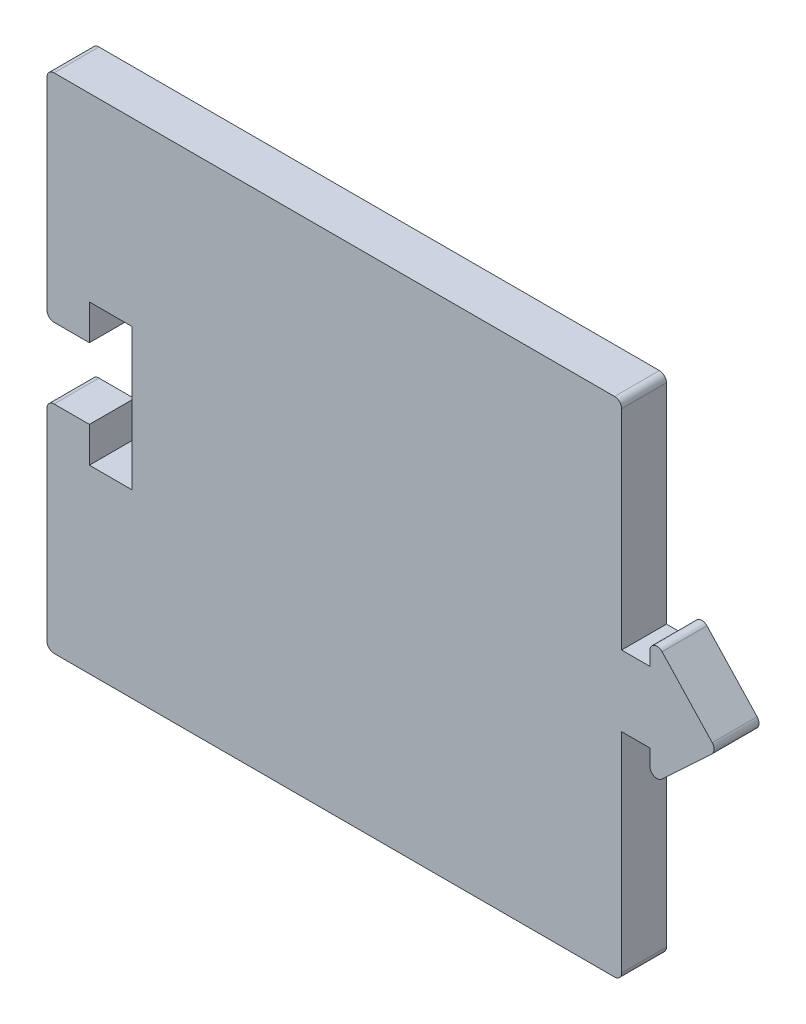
SolidWorks part; units mm, degrees
ref_plane "Front" through (0, 0, 0) normal (0, 0, 1) x (1, 0, 0)
ref_plane "Top" through (0, 0, 0) normal (0, 1, 0) x (1, 0, 0)
ref_plane "Right" through (0, 0, 0) normal (1, 0, 0) x (0, 0, -1)
sketch "Sketch1" plane through (0, 0, 0) normal (0, 0, 1) x (1, 0, 0)
  line L0 (0, 0) -> (0, 15.28) construction
  line L1 (40.64, 35.56) -> (40.64, 20.28)
  line L2 (40.64, 0) -> (0, 0) construction
  line L3 (0, 35.56) -> (40.64, 35.56) construction
  line L4 (0, 17.78) -> (40.64, 17.78) construction
  line L5 (20.32, 35.56) -> (20.32, 0) construction
  line L6 (0, 35.56) -> (40.64, 35.56)
  line L7 (0, 0) -> (40.64, 0)
  line L8 (40.64, 20.28) -> (42.64, 20.28)
  line L9 (42.64, 20.28) -> (42.64, 22.53)
  line L10 (42.64, 22.53) -> (47.39, 17.445)
  line L11 (47.39, 17.445) -> (42.64, 13.0079)
  line L12 (42.64, 13.0079) -> (42.64, 15.28)
  line L13 (42.64, 15.28) -> (40.64, 15.28)
  line L14 (0, 20.28) -> (3, 20.28)
  line L15 (3, 20.28) -> (3, 22.78)
  line L16 (0, 35.56) -> (0, 20.28)
  line L17 (0, 20.28) -> (0, 35.56) construction
  line L18 (0, 15.28) -> (0, 0)
  line L19 (3, 22.78) -> (6, 22.78)
  line L20 (6, 22.78) -> (6, 12.78)
  line L21 (40.64, 15.28) -> (40.64, 0)
  line L22 (6, 12.78) -> (3, 12.78)
  line L23 (0, 15.28) -> (3, 15.28)
  line L24 (3, 12.78) -> (3, 15.28)
  point P17 (6, 17.78)
  dimension "D10" = 2.5
  dimension "D1" = 35.56
  dimension "D2" = 2
  dimension "D3" = 40.64
  dimension "D4" = 6.5
  dimension "D5" = 2.25
  dimension "D6" = 2.5
  dimension "D7" = 3
  dimension "D8" = 3
  dimension "D9" = 2.5
extrude "Boss-Extrude1" add sketch "Sketch1" along normal blind 3.175
sketch "Sketch2" plane through (0, 0, 3.175) normal (0, 0, 1) x (1, 0, 0)
  line L1 (10.5865, 4.4677) -> (35.9865, 4.4677)
  line L2 (10.5865, 4.4677) -> (10.5865, 29.8677)
  line L3 (10.5865, 29.8677) -> (35.9865, 29.8677)
  line L4 (35.9865, 4.4677) -> (35.9865, 29.8677)
  dimension "D1" = 25.4
extrude "Cut-Extrude1" [suppressed] cut sketch "Sketch2" against normal blind 1
fillet "Fillet1" radius 0.5 9 edges at (40.64, 0, 1.5875) (0, 0, 1.5875) (0, 15.28, 1.5875) (0, 20.28, 1.5875) (40.64, 35.56, 1.5875) (0, 35.56, 1.5875) (42.64, 13.0079, 1.5875) (47.39, 17.445, 1.5875) (42.64, 22.53, 1.5875)
